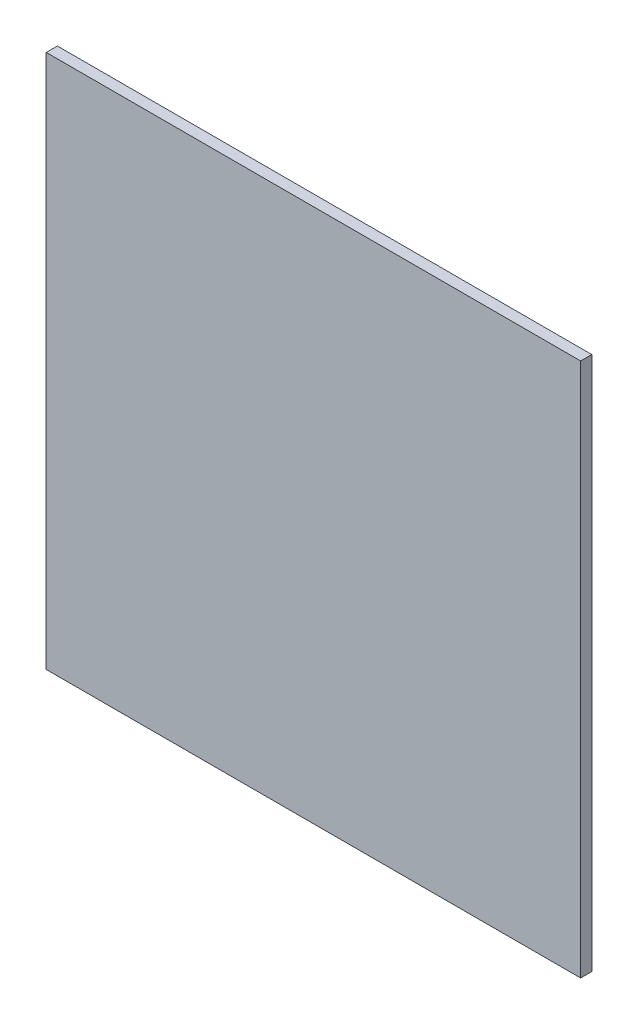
SolidWorks part; units mm, degrees
ref_plane "Plane1" through (0, 0, 0) normal (0, 0, 1) x (1, 0, 0)
ref_plane "Plane2" through (0, 0, 0) normal (0, 1, 0) x (1, 0, 0)
ref_plane "Plane3" through (0, 0, 0) normal (1, 0, 0) x (0, 0, -1)
sketch "Sketch1" plane through (0, 0, 0) normal (0, 0, 1) x (1, 0, 0)
  line L1 (-279.4, -279.4) -> (25.4, -279.4)
  line L2 (-279.4, -279.4) -> (-279.4, 25.4)
  line L3 (-279.4, 25.4) -> (25.4, 25.4)
  line L4 (25.4, -279.4) -> (25.4, 25.4)
  dimension "D1" = 304.8
  dimension "D2" = 304.8
extrude "Base-Extrude" add sketch "Sketch1" along normal blind 6.35
